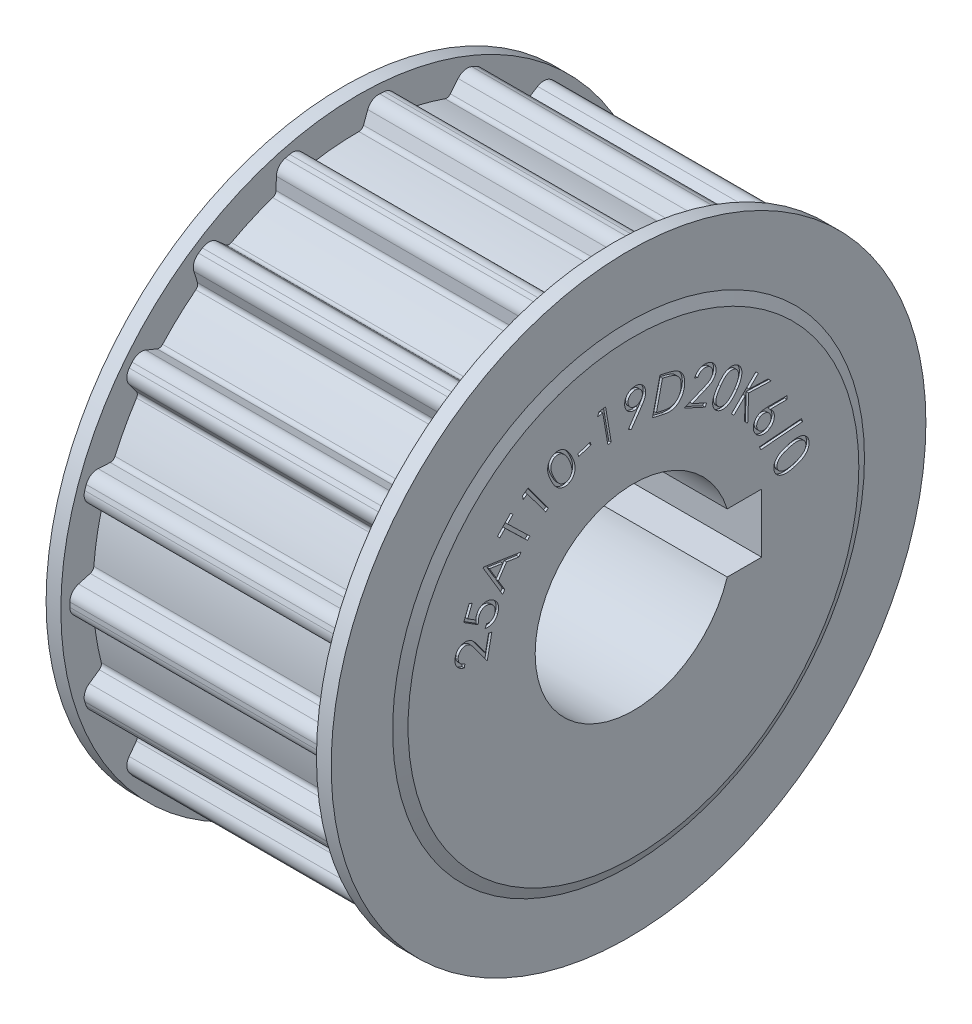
SolidWorks part; units mm, degrees
ref_plane "Front Plane" through (0, 0, 0) normal (0, 0, 1) x (1, 0, 0)
ref_plane "Top Plane" through (0, 0, 0) normal (0, 1, 0) x (1, 0, 0)
ref_plane "Right Plane" through (0, 0, 0) normal (1, 0, 0) x (0, 0, -1)
imported_body "Imported1"
sketch "Sketch1" plane through (-11.55, 0, 0) normal (-1, 0, 0) x (0, 0, 1)
  circle A0 centre (0, 0) radius 24
  circle A1 centre (0, 0) radius 30.25
extrude "Boss-Extrude1" add sketch "Sketch1" along normal blind 0.7
sketch "Sketch2" plane through (16.05, 0, 0) normal (1, 0, 0) x (0, 0, -1)
  circle A0 centre (0, 0) radius 24
  circle A1 centre (0, 0) radius 30.25
extrude "Boss-Extrude2" add sketch "Sketch2" along normal blind 0.7
sketch "Sketch3" plane through (-11.75, 0, 0) normal (-1, 0, 0) x (0, 0, 1)
  line L0 (-9.5394, 3) -> (-12.0094, 3)
  line L1 (-12.0094, 3) -> (-12.0094, -3)
  line L2 (-12.0094, -3) -> (-9.5394, -3)
  circle A0 centre (0, 0) radius 24
  arc A1 (-9.5394, -3) -> (-9.5394, 3) centre (0, 0) ccw
extrude "Boss-Extrude3" add sketch "Sketch3" along normal blind 1
sketch "Sketch4" plane through (16.25, 0, 0) normal (1, 0, 0) x (0, 0, -1)
  line L0 (12.0094, -3) -> (9.5394, -3)
  line L1 (12.0094, -3) -> (12.0094, 3)
  line L2 (12.0094, 3) -> (9.5394, 3)
  circle A0 centre (0, 0) radius 24
  arc A1 (9.5394, 3) -> (9.5394, -3) centre (0, 0) ccw
extrude "Boss-Extrude4" add sketch "Sketch4" along normal blind 1
chamfer "Chamfer1" distance 0.5 angle 65 2 edges at (-12.75, 0, 24) (17.25, 0, -24)
sketch "Sketch5" plane through (17.25, 0, 0) normal (1, 0, 0) x (0, 0, -1)
  circle A0 centre (0, 0) radius 15 construction
  text T0 "25AT10-19D20K6/0  "
  dimension "D1" = 30
extrude "Cut-Extrude1" cut sketch "Sketch5" against normal blind 0.25
sketch "Sketch6" plane through (17.25, 0, 0) normal (1, 0, 0) x (0, 0, -1)
  line L0 (12.0094, -3) -> (13.0394, -3)
  line L1 (12.0094, 3) -> (13.0394, 3)
  line L2 (13.0394, 3) -> (13.0394, -3)
  line L3 (12.0094, -3) -> (12.0094, 3)
extrude "Cut-Extrude2" cut sketch "Sketch6" against normal through all
